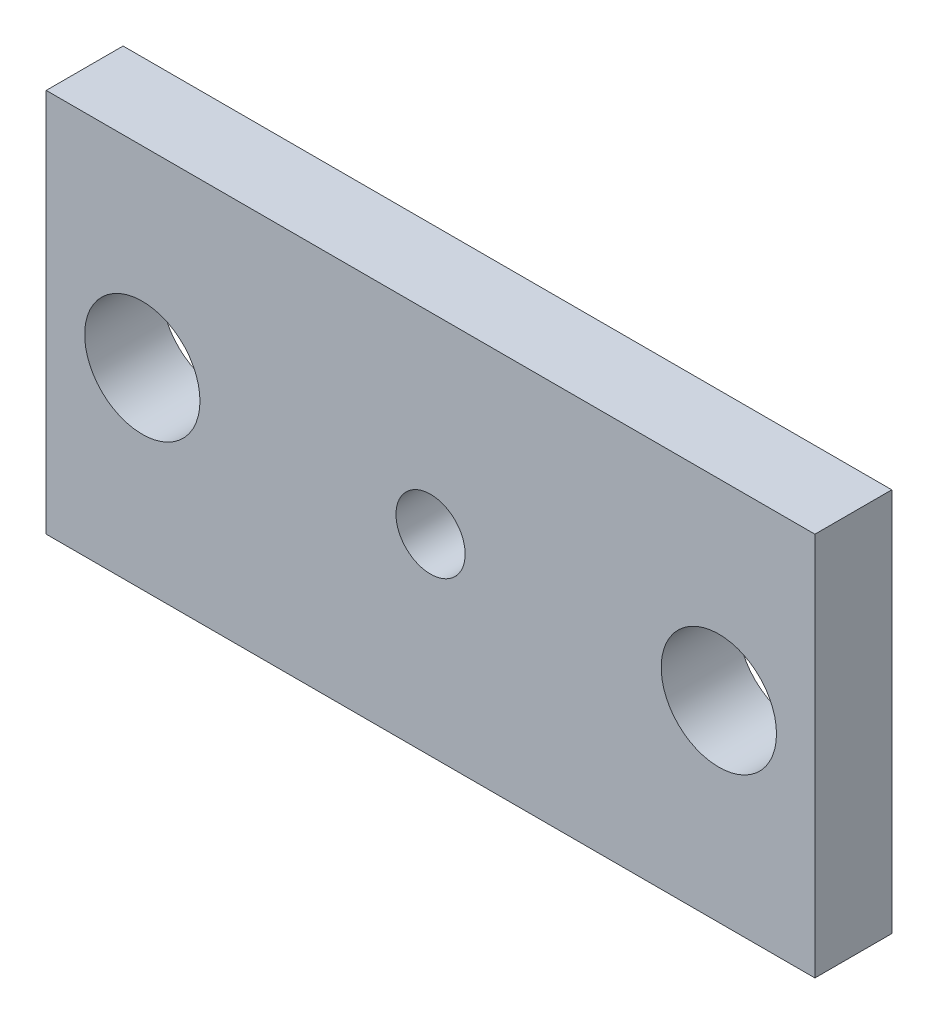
SolidWorks part; units mm, degrees
ref_plane "Front Plane" through (0, 0, 0) normal (0, 0, 1) x (1, 0, 0)
ref_plane "Top Plane" through (0, 0, 0) normal (0, 1, 0) x (1, 0, 0)
ref_plane "Right Plane" through (0, 0, 0) normal (1, 0, 0) x (0, 0, -1)
ref_plane "Plane1" through (0, 0, -6.35) normal (0, 0, -1) x (-1, 0, 0)
sketch "Sketch1" plane through (0, 0, -6.35) normal (0, 0, -1) x (-1, 0, 0)
  line L0 (-25.4, 12.7) -> (-25.4, 0)
  line L1 (-25.4, 0) -> (0, 0)
  line L2 (0, 0) -> (0, 12.7)
  line L3 (0, 12.7) -> (-25.4, 12.7)
  circle A0 centre (-22.225, 6.35) radius 1.905
  circle A1 centre (-3.175, 6.35) radius 1.905
  circle A2 centre (-12.7, 6.35) radius 1.143
  dimension "D1" = 2.286
extrude "Boss-Extrude1" add sketch "Sketch1" against normal blind 2.54
